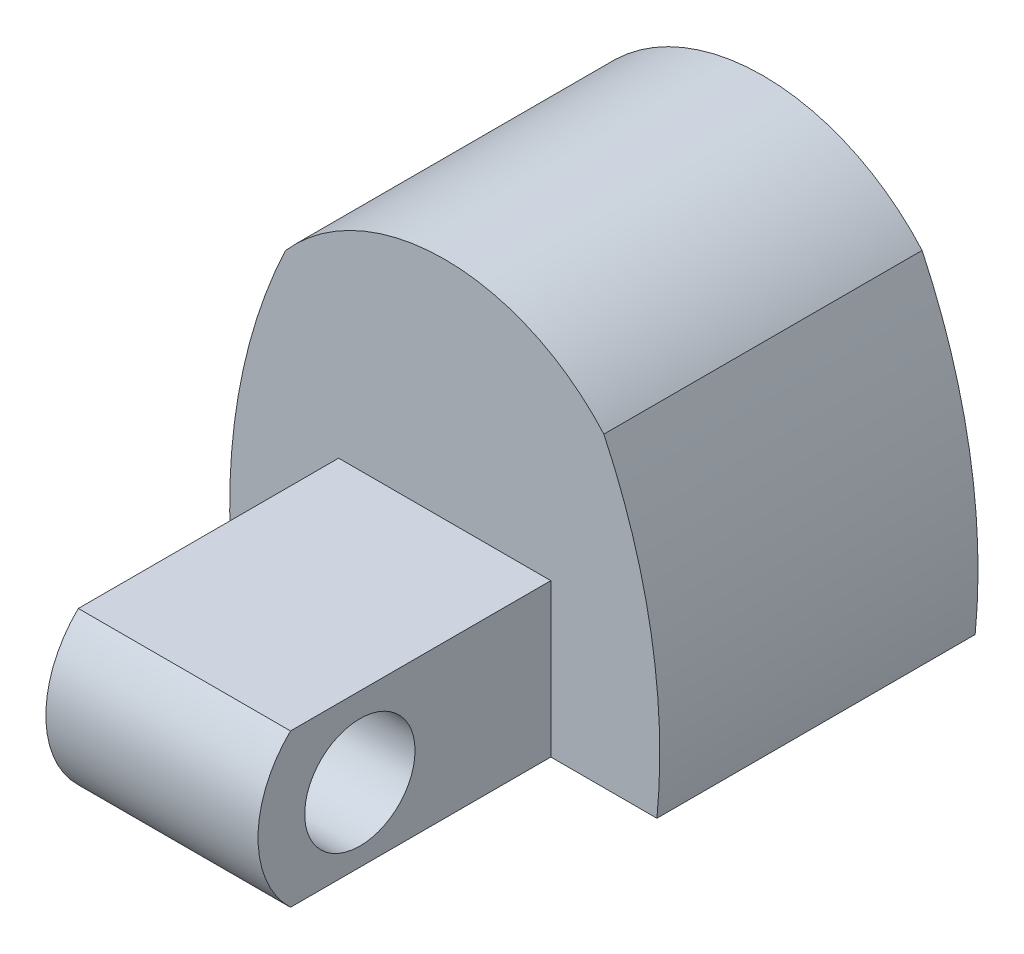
SolidWorks part; units mm, degrees
ref_plane "Alzado" through (0, 0, 0) normal (0, 0, 1) x (1, 0, 0)
ref_plane "Planta" through (0, 0, 0) normal (0, 1, 0) x (1, 0, 0)
ref_plane "Vista lateral" through (0, 0, 0) normal (1, 0, 0) x (0, 0, -1)
sketch "Croquis1" plane through (0, 0, 0) normal (0, 0, 1) x (1, 0, 0)
  line L0 (-10, 0) -> (-7.5, 0)
  line L1 (-7.5, 14.43) -> (7.5, 14.43)
  line L2 (-7.5, 14.43) -> (-7.5, 0)
  line L3 (-7.5, 0) -> (7.5, 0)
  line L4 (7.5, 14.43) -> (7.5, 0)
  line L5 (0, 0) -> (0, 14.43) construction
  line L6 (0, 14.43) -> (0, 0) construction
  line L7 (10, 0) -> (7.5, 0)
  arc A0 (-7.5, 14.43) -> (-10, 0) centre (17.2248, 2.7149) ccw
  arc A1 (-7.5, 14.43) -> (7.5, 14.43) centre (0, 7.8156) cw
  arc A2 (7.5, 14.43) -> (10, 0) centre (-17.2248, 2.7149) cw
  point P4 (0, 0)
  dimension "D4" = 10
  dimension "D1" = 15
  dimension "D2" = 14.43
  dimension "D3" = 2.5
extrude "Saliente-Extruir1" add sketch "Croquis1" along normal blind 15 contours A1 L1 | A2 L4 L7 | L2 A0 L0
sketch "Croquis2" plane through (0, 0, 0) normal (1, 0, 0) x (0, 0, -1)
  line L0 (0, 17.8156) -> (-15, 17.8156) construction
  line L1 (-15, 14.43) -> (-15, 0) construction
  line L2 (-24, 3.4656) -> (0.1131, 3.4656) construction
  line L5 (-15, 0) -> (-27.2699, 0)
  line L6 (-27.2699, 7.2) -> (-15, 7.2)
  line L7 (-15, 7.2) -> (-15, 0)
  circle A0 centre (-24, 3.4656) radius 2.6
  arc A9 (-27.2699, 0) -> (-27.2699, 7.2) centre (-23.8, 3.6) cw
  point P6 (-28.8, 3.6)
sketch "Croquis4" plane through (0, 0, 0) normal (0, 0, -1) x (-1, 0, 0)
  line L0 (0, 0) -> (0, 18.3542) construction
  line L1 (-10, 0) -> (10, 0) construction
  line L2 (-11.8052, 0) -> (12.4312, 0) construction
  line L3 (-8.45, 0) -> (8.45, 0)
  arc A0 (0, 15.5) -> (-8.45, 0) centre (2.9126, 3.8588) ccw
  arc A1 (0, 15.5) -> (8.45, 0) centre (-2.9126, 3.8588) cw
  point P11 (0, 0)
  dimension "D2" = 12
  dimension "D1" = 0
  dimension "D3" = 1.55
  dimension "D4" = 15.5
extrude "Cortar-Extruir1" cut sketch "Croquis4" against normal blind 12
ref_plane "Plano1" through (9, 0, 0) normal (1, 0, 0) x (0, 0, -1)
sketch "Croquis5" plane through (9, 0, 0) normal (1, 0, 0) x (0, 0, -1)
  line L0 (0, 17.8156) -> (-15, 17.8156) construction
  line L1 (0, 0) -> (0, 14.43) construction
  circle A0 centre (-2.5, 3.4656) radius 2
extrude "Saliente-Extruir3" add sketch "Croquis5" against normal blind 18
sketch "Croquis6" plane through (0, 0, 0) normal (0, -1, 0) x (1, 0, 0)
  line L0 (10, 0) -> (8.45, 0) construction
  line L1 (-9, 0) -> (9, 0)
  line L2 (-9, 0) -> (-9, 12)
  line L3 (-9, 12) -> (9, 12)
  line L4 (9, 0) -> (9, 12)
  line L5 (-10, 15) -> (-10, 0) construction
  line L6 (10, 15) -> (10, 0) construction
  line L7 (10, 15) -> (-10, 15) construction
  dimension "D1" = 1
  dimension "D2" = 1
  dimension "D3" = 3
extrude "Saliente-Extruir4" add sketch "Croquis2" against normal blind 5 and the other way blind 5
equation "\"conexiones\"=14.35"
equation "\"D2@Croquis2\"=\"conexiones\""
equation "\"D2@Croquis5\"=\"conexiones\""
